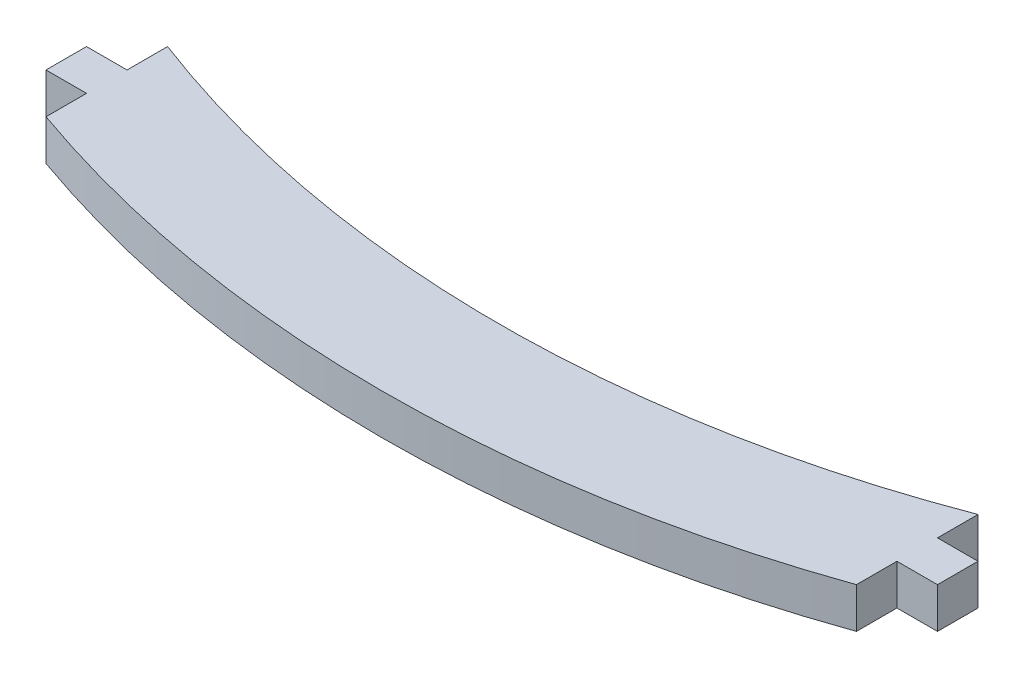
SolidWorks part; units mm, degrees
ref_plane "Front Plane" through (0, 0, 0) normal (0, 0, 1) x (1, 0, 0)
ref_plane "Top Plane" through (0, 0, 0) normal (0, 1, 0) x (1, 0, 0)
ref_plane "Right Plane" through (0, 0, 0) normal (1, 0, 0) x (0, 0, -1)
sketch "Sketch1" plane through (0, 0, 0) normal (0, 1, 0) x (1, 0, 0)
  line L0 (0, 0) -> (0, 84.8528) construction
  line L1 (-30, 0) -> (30, 0) construction
  line L2 (-30, 0) -> (-30, 9)
  line L3 (-30, 9) -> (30, 9) construction
  line L4 (30, 9) -> (30, 0)
  line L5 (0, 84.8528) -> (0, 87.8528) construction
  arc A0 (-30, 0) -> (30, 0) centre (0, 84.8528) ccw
  arc A1 (-30, 9) -> (30, 9) centre (0, 87.8528) ccw
  point P5 (0, 0)
  dimension "D3" = 90
  dimension "D1" = 60
  dimension "D2" = 9
  dimension "D4" = 3
extrude "Boss-Extrude1" add sketch "Sketch1" along normal blind 3
sketch "Sketch2" plane through (0, 0, 0) normal (0, 1, 0) x (1, 0, 0)
  line L0 (-30, 4.5) -> (-31.5, 4.5) construction
  line L1 (-30, 9) -> (-30, 0) construction
  line L2 (0, 0) -> (0, 22.2209) construction
  line L3 (-33, 6) -> (-30, 6)
  line L4 (-33, 6) -> (-33, 3)
  line L5 (-33, 3) -> (-30, 3)
  line L6 (-30, 6) -> (-30, 3)
  line L7 (-33, 6) -> (-30, 3) construction
  line L8 (-33, 3) -> (-30, 6) construction
  line L9 (33, 3) -> (30, 6) construction
  line L10 (33, 6) -> (30, 3) construction
  line L11 (30, 4.5) -> (31.5, 4.5) construction
  line L12 (30, 6) -> (30, 3)
  line L13 (33, 3) -> (30, 3)
  line L14 (33, 6) -> (33, 3)
  line L15 (33, 6) -> (30, 6)
  dimension "D1" = 3
  dimension "D2" = 3
extrude "Boss-Extrude2" add sketch "Sketch2" along normal blind 3
